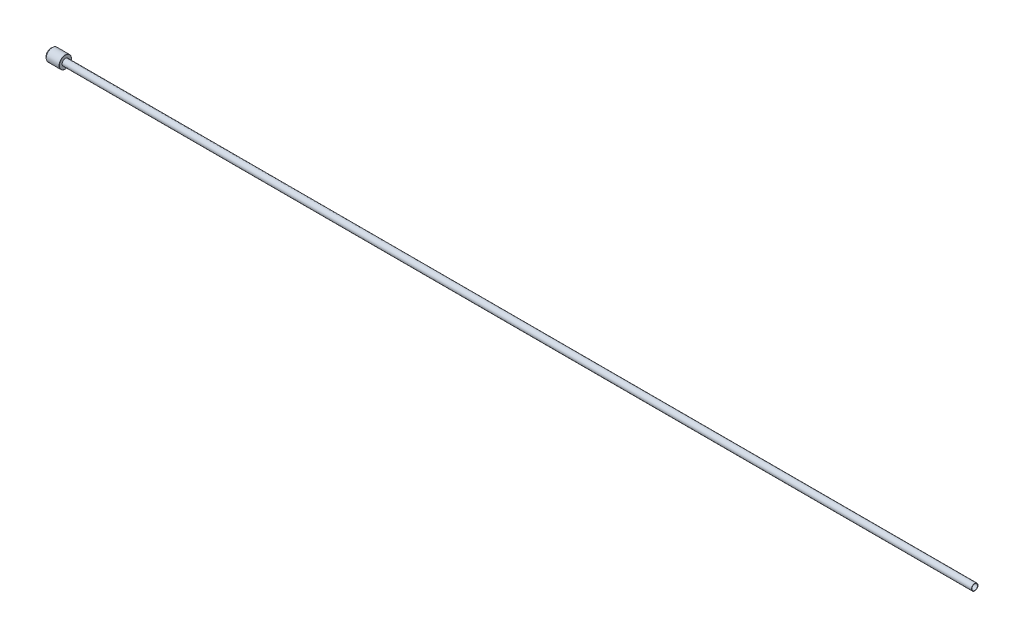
SolidWorks part; units mm, degrees
ref_plane "Front Plane" through (0, 0, 0) normal (0, 0, 1) x (1, 0, 0)
ref_plane "Top Plane" through (0, 0, 0) normal (0, 1, 0) x (1, 0, 0)
ref_plane "Right Plane" through (0, 0, 0) normal (1, 0, 0) x (0, 0, -1)
sketch "Sketch1" plane through (0, 0, 0) normal (0, 0, 1) x (1, 0, 0)
  line L0 (0.66, 3) -> (6, 3)
  line L1 (7, 1.5875) -> (450, 1.5875)
  line L2 (6, 3) -> (7, 3)
  line L4 (7, 3) -> (7, 1.5875)
  line L5 (450, 1.5875) -> (450, 1.3843)
  line L7 (450, 1.3843) -> (0, 1.3843)
  line L8 (0, 1.3843) -> (0, 2.44)
  line L9 (-22.2122, 0) -> (63.2184, 0) construction
  line L10 (0, 2.44) -> (0.1, 2.44)
  line L12 (0.1, 2.44) -> (0.66, 3)
  dimension "D2" = 6
  dimension "Thread" = 6
  dimension "D3" = 7
  dimension "D4" = 2.7686
  dimension "D5" = 3.175
  dimension "D6" = 450
  dimension "minor diameter" = 4.88
  dimension "D9" = 45
  dimension "D10" = 0.1
revolve "Revolve1" add sketch "Sketch1" angle 360 about L9
fillet "Fillet3" radius 0.1 1 edges at (7, 0, 3)
